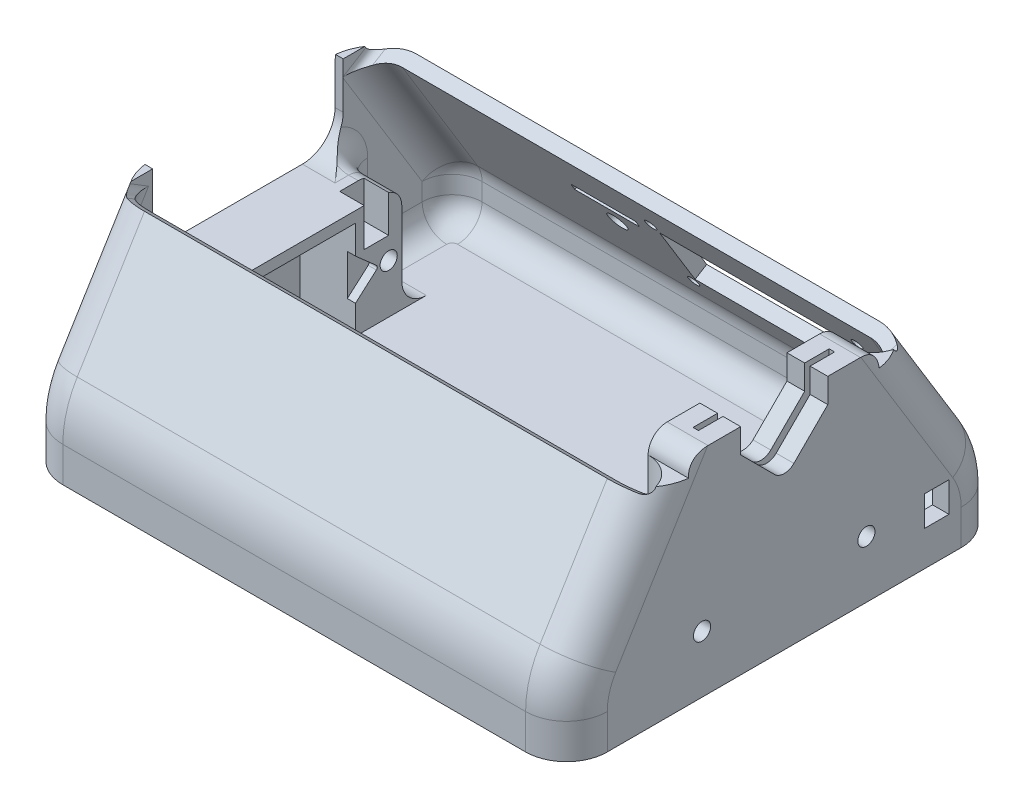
SolidWorks part; units mm, degrees
ref_plane "Front Plane" through (0, 0, 0) normal (0, 0, 1) x (1, 0, 0)
ref_plane "Top Plane" through (0, 0, 0) normal (0, 1, 0) x (1, 0, 0)
ref_plane "Right Plane" through (0, 0, 0) normal (1, 0, 0) x (0, 0, -1)
imported_body "base-1-solid1"
imported_body "Motor Cover-1-solid1"
imported_body "injectionholder-1-solid1"
combine bodies "Combine1" operation type add bodies to combine 102 101 103
sketch "Sketch1" plane through (-5.1704, 0, 0) normal (-1, 0, 0) x (0, 0, 1)
  line L0 (76.7153, 97.4092) -> (76.7153, 117.4092)
  line L1 (121.7153, 130.4092) -> (121.7153, 166.4092)
  line L2 (121.7153, 166.4092) -> (106.7153, 166.4092)
  line L3 (76.7153, 117.4092) -> (106.7153, 166.4092)
  line L4 (76.7153, 117.4092) -> (121.7153, 117.4092) construction
  line L5 (121.7153, 130.4092) -> (121.7153, 97.4092) construction
  line L6 (121.7153, 130.4092) -> (121.7153, 97.4092)
  line L7 (121.7153, 97.4092) -> (76.7153, 97.4092)
  dimension "D1" = 20
  dimension "D2" = 15
  dimension "D3" = 69
extrude "Boss-Extrude1" add sketch "Sketch1" against normal blind 3 separate body
sketch "Sketch2" plane through (194.8296, 0, 0) normal (1, 0, 0) x (0, 0, -1)
  line L0 (-76.7153, 97.4092) -> (-76.7153, 117.4092)
  line L1 (-76.7153, 117.4092) -> (-106.7153, 166.4092)
  line L2 (-106.7153, 166.4092) -> (-121.7153, 166.4092)
  line L3 (-121.7153, 166.4092) -> (-121.7153, 97.4092)
  line L4 (-121.7153, 97.4092) -> (-76.7153, 97.4092)
extrude "Boss-Extrude2" add sketch "Sketch2" against normal blind 3
combine bodies "Combine2" operation type add bodies to combine 105 106
sketch "Sketch4" plane through (-5.1704, 0, 0) normal (-1, 0, 0) x (0, 0, 1)
  line L0 (191.7153, 97.4092) -> (191.7153, 166.4092)
  line L1 (191.7153, 166.4092) -> (206.7153, 166.4092)
  line L2 (191.7153, 97.4092) -> (236.7153, 97.4092)
  line L3 (236.7153, 97.4092) -> (236.7153, 117.4092)
  line L4 (236.7153, 117.4092) -> (206.7153, 166.4092)
  dimension "D1" = 15
  dimension "D2" = 20
extrude "Boss-Extrude3" add sketch "Sketch4" against normal blind 3
sketch "Sketch5" plane through (194.8296, 0, 0) normal (1, 0, 0) x (0, 0, -1)
  line L0 (-191.7153, 97.4092) -> (-191.7153, 166.4092)
  line L1 (-191.7153, 166.4092) -> (-206.7153, 166.4092)
  line L2 (-206.7153, 166.4092) -> (-236.7153, 117.4092)
  line L3 (-236.7153, 117.4092) -> (-236.7153, 97.4092)
  line L4 (-236.7153, 97.4092) -> (-191.7153, 97.4092)
extrude "Boss-Extrude4" add sketch "Sketch5" against normal blind 3
sketch "Sketch6" plane through (0, 0, 236.7153) normal (0, 0, 1) x (1, 0, 0)
  line L1 (-5.1704, 94.4092) -> (194.8296, 94.4092)
  line L2 (-5.1704, 94.4092) -> (-5.1704, 117.4092)
  line L3 (-5.1704, 117.4092) -> (194.8296, 117.4092)
  line L4 (194.8296, 94.4092) -> (194.8296, 117.4092)
extrude "Boss-Extrude5" add sketch "Sketch6" against normal blind 3
sketch "Sketch8" plane through (0, 137.425, 224.4608) normal (0, 0.5222, 0.8529) x (1, 0, 0)
  line L1 (194.8296, 33.9851) -> (-5.1704, 33.9851)
  line L2 (194.8296, 33.9851) -> (194.8296, -23.4692)
  line L3 (194.8296, -23.4692) -> (-5.1704, -23.4692)
  line L4 (-5.1704, 33.9851) -> (-5.1704, -23.4692)
extrude "Boss-Extrude8" add sketch "Sketch8" against normal blind 3
sketch "Sketch9" plane through (0, 0, 76.7153) normal (0, 0, -1) x (-1, 0, 0)
  line L1 (-194.8296, 117.4092) -> (5.1704, 117.4092)
  line L2 (-194.8296, 117.4092) -> (-194.8296, 94.4092)
  line L3 (-194.8296, 94.4092) -> (5.1704, 94.4092)
  line L4 (5.1704, 117.4092) -> (5.1704, 94.4092)
extrude "Boss-Extrude9" add sketch "Sketch9" against normal blind 5
sketch "Sketch10" plane through (0, -2.1519, 3.5147) normal (0, 0.5222, -0.8529) x (-1, 0, 0)
  line L1 (-194.8296, 197.6441) -> (5.1704, 197.6441)
  line L2 (-194.8296, 197.6441) -> (-194.8296, 140.1898)
  line L3 (-194.8296, 140.1898) -> (5.1704, 140.1898)
  line L4 (5.1704, 197.6441) -> (5.1704, 140.1898)
extrude "Boss-Extrude10" add sketch "Sketch10" against normal blind 5
sketch "Sketch11" plane through (0, -2.1519, 3.5147) normal (0, 0.5222, -0.8529) x (-1, 0, 0)
  line L0 (-94.8296, 197.6441) -> (-94.8296, 140.1898) construction
  line L1 (2.1704, 197.6441) -> (-191.8296, 197.6441) construction
  line L2 (-194.8296, 140.1898) -> (5.1704, 140.1898) construction
  line L5 (-94.8296, 181.417) -> (-94.8296, 156.417) construction
  line L6 (-130.8296, 181.417) -> (-130.8296, 156.417) construction
  line L7 (-94.8296, 181.417) -> (-166.8296, 181.417)
  line L8 (-94.8296, 181.417) -> (-94.8296, 156.417)
  line L9 (-94.8296, 156.417) -> (-166.8296, 156.417)
  line L10 (-166.8296, 181.417) -> (-166.8296, 156.417)
  line L11 (-170.8296, 186.917) -> (-168.7102, 184.0069) construction
  line L12 (-170.8296, 186.917) -> (-90.8296, 186.917) construction
  line L13 (-170.8296, 186.917) -> (-170.8296, 150.917) construction
  line L14 (-170.8296, 150.917) -> (-90.8296, 150.917) construction
  line L15 (-90.8296, 186.917) -> (-90.8296, 150.917) construction
  line L16 (-170.8296, 186.917) -> (-90.8296, 150.917) construction
  line L17 (-170.8296, 150.917) -> (-90.8296, 186.917) construction
  line L18 (-170.8296, 150.917) -> (-168.701, 153.8203) construction
  line L19 (-90.8296, 186.917) -> (-92.9035, 183.9744) construction
  line L20 (-90.8296, 150.917) -> (-92.9466, 153.8287) construction
  line L22 (-66.7296, 175.017) -> (-66.7296, 177.517) construction
  line L23 (-78.9296, 175.017) -> (-66.7296, 175.017) construction
  line L24 (-78.9296, 175.017) -> (-78.9296, 162.817) construction
  line L25 (-78.9296, 162.817) -> (-66.7296, 162.817) construction
  line L26 (-66.7296, 175.017) -> (-66.7296, 162.817) construction
  line L27 (-78.9296, 175.017) -> (-66.7296, 162.817) construction
  line L28 (-78.9296, 162.817) -> (-66.7296, 175.017) construction
  line L29 (-31.5756, 177.517) -> (-51.5756, 177.517) construction
  line L30 (-90.8296, 168.917) -> (-72.8296, 168.917) construction
  line L35 (-72.8296, 168.917) -> (-72.8296, 177.517) construction
  line L36 (-72.8296, 177.517) -> (-90.8296, 177.517) construction
  line L37 (-84.7379, 179.017) -> (-60.9212, 179.017)
  line L38 (-84.7379, 179.017) -> (-84.7379, 176.017)
  line L39 (-84.7379, 176.017) -> (-60.9212, 176.017)
  line L40 (-60.9212, 179.017) -> (-60.9212, 176.017)
  line L41 (-84.7379, 179.017) -> (-60.9212, 176.017) construction
  line L42 (-84.7379, 176.017) -> (-60.9212, 179.017) construction
  circle A0 centre (-168.7102, 184.0069) radius 2
  circle A1 centre (-92.9035, 183.9744) radius 2
  circle A2 centre (-92.9466, 153.8287) radius 2
  circle A3 centre (-168.701, 153.8203) radius 2
  circle A4 centre (-72.8296, 168.917) radius 3.5
  point P11 (-94.8296, 168.917)
  point P14 (-94.8296, 168.917)
  point P18 (-130.8296, 168.917)
  point P41 (-41.5756, 177.517)
  dimension "D9" = 4
  dimension "D10" = 4
  dimension "D11" = 4
  dimension "D12" = 4
  dimension "D13" = 7
  dimension "D1" = 25
  dimension "D2" = 72
  dimension "D3" = 80
  dimension "D4" = 36
  dimension "D5" = 3.6
  dimension "D6" = 3.6
  dimension "D7" = 3.6
  dimension "D8" = 3.6
  dimension "D14" = 12.2
  dimension "D15" = 12.2
  dimension "D16" = 2.5
  dimension "D17" = 3
  dimension "D19" = 18
extrude "Cut-Extrude1" cut sketch "Sketch11" against normal blind 7
sketch "Sketch12" plane through (0, -2.1519, 3.5147) normal (0, 0.5222, -0.8529) x (-1, 0, 0)
  circle A0 centre (-168.7102, 184.0069) radius 3
  circle A1 centre (-92.9035, 183.9744) radius 3
  circle A2 centre (-168.701, 153.8203) radius 3
  circle A3 centre (-92.9466, 153.8287) radius 3
  dimension "D1" = 6
  dimension "D2" = 6
  dimension "D3" = 6
  dimension "D4" = 6
extrude "Cut-Extrude2" cut sketch "Sketch12" against normal blind 1.2
sketch "Sketch13" plane through (0, -2.1519, 3.5147) normal (0, 0.5222, -0.8529) x (-1, 0, 0)
  line L0 (-72.8296, 179.017) -> (-72.8296, 176.017) construction
  line L3 (-60.9212, 179.017) -> (-84.7379, 179.017) construction
  line L8 (-84.7379, 176.017) -> (-60.9212, 176.017) construction
  line L10 (-85.8296, 180.517) -> (-59.8296, 180.517)
  line L11 (-85.8296, 180.517) -> (-85.8296, 174.517)
  line L12 (-85.8296, 174.517) -> (-59.8296, 174.517)
  line L13 (-59.8296, 180.517) -> (-59.8296, 174.517)
  line L14 (-85.8296, 180.517) -> (-59.8296, 174.517) construction
  line L15 (-85.8296, 174.517) -> (-59.8296, 180.517) construction
  point P6 (-72.8296, 177.517)
  dimension "D1" = 26
  dimension "D2" = 6
extrude "Cut-Extrude3" cut sketch "Sketch13" against normal blind 2
fillet "Fillet2" radius 12 2 edges at (191.8296, 131.9092, 191.7153) (191.8296, 131.9092, 121.7153)
fillet "Fillet3" radius 12 2 edges at (-3.6704, 130.4092, 121.7153) (-5.1704, 135.359, 123.7656)
fillet "Fillet4" radius 12 2 edges at (-3.6704, 130.4092, 191.7153) (-5.1704, 135.359, 189.6651)
fillet "Fillet5" radius 9 6 edges at (-2.1704, 137.4092, 131.2153) (-2.1704, 135.359, 123.7656) (-2.1704, 137.4092, 182.2153) (-2.1704, 135.359, 189.6651) (-2.1704, 113.9092, 121.7153) (-2.1704, 113.9092, 191.7153)
fillet "Fillet6" radius 11 10 edges at (94.8296, 116.0002, 81.7153) (94.8296, 116.5638, 233.7153) (191.8296, 140.7033, 218.9361) (191.8296, 106.9865, 233.7153) (-2.1704, 106.9865, 233.7153) (-2.1704, 140.7033, 218.9361) (191.8296, 106.7047, 81.7153) (191.8296, 138.8668, 95.7153) (-2.1704, 106.7047, 81.7153) (-2.1704, 139.8993, 96.3475)
fillet "Fillet7" radius 9 16 edges at (13.0896, 97.4092, 121.7153) (0.4656, 97.4092, 119.0793) (-2.1704, 97.4092, 102.7153) (1.0514, 97.4092, 84.9372) (188.3148, 97.4092, 118.2006) (191.8296, 97.4092, 101.2153) (188.6077, 97.4092, 84.9372) (13.0896, 97.4092, 191.7153) (0.4656, 97.4092, 194.3514) (-2.1704, 97.4092, 211.7153) (1.0514, 97.4092, 230.4935) (188.3148, 97.4092, 195.2301) (191.8296, 97.4092, 213.2153) (188.6077, 97.4092, 230.4935) (94.8296, 97.4092, 81.7153) (94.8296, 97.4092, 233.7153)
fillet "Fillet8" radius 36 2 edges at (94.8296, 117.4092, 76.7153) (94.8296, 117.4092, 236.7153)
fillet "Fillet9" radius 15 22 edges at (-5.1704, 166.4092, 199.2153) (194.8296, 166.4092, 199.2153) (194.8296, 146.2354, 219.0667) (191.8296, 165.4908, 205.2153) (191.8296, 165.4908, 108.2153) (-5.1704, 100.8366, 236.7153) (194.8296, 100.8366, 76.7153) (194.8296, 166.4092, 114.2153) (194.8296, 100.8366, 236.7153) (191.8296, 166.4092, 205.2153) (191.8296, 165.4908, 203.7153) (191.8296, 165.4908, 109.7153) (191.8296, 166.4092, 108.2153) (194.8296, 146.2354, 94.364) (-5.1704, 100.8366, 76.7153) (-5.1704, 146.2354, 219.0667) (-5.1704, 117.0289, 235.3657) (-5.1704, 117.0289, 78.065) (194.8296, 117.0289, 235.3657) (194.8296, 117.0289, 78.065) (-5.1704, 146.2354, 94.364) (-5.1704, 166.4092, 114.2153)
sketch "Sketch15" plane through (179.8296, 0, 0) normal (-1, 0, 0) x (0, 0, 1)
  line L0 (126.5303, 115.4092) -> (126.5303, 123.4092) construction
  line L2 (126.5303, 123.4092) -> (135.5303, 123.4092)
  line L3 (126.5303, 123.4092) -> (126.5303, 163.4092)
  line L4 (126.5303, 163.4092) -> (135.5303, 163.4092)
  line L5 (135.5303, 123.4092) -> (135.5303, 163.4092)
  dimension "D1" = 8
  dimension "D2" = 9
  dimension "D3" = 40
extrude "Cut-Extrude5" cut sketch "Sketch15" against normal blind 9
sketch "Sketch16" plane through (19.3496, 0, 0) normal (1, 0, 0) x (0, 0, -1)
  line L0 (-126.5303, 115.4092) -> (-126.5303, 123.4092) construction
  line L2 (-126.5303, 123.4092) -> (-135.5303, 123.4092)
  line L3 (-126.5303, 123.4092) -> (-126.5303, 143.4092)
  line L4 (-126.5303, 143.4092) -> (-135.5303, 143.4092)
  line L5 (-135.5303, 123.4092) -> (-135.5303, 143.4092)
  dimension "D1" = 8
  dimension "D2" = 9
  dimension "D3" = 20
extrude "Cut-Extrude6" cut sketch "Sketch16" against normal blind 9
sketch "Sketch17" plane through (194.8296, 0, 0) normal (1, 0, 0) x (0, 0, -1)
  line L0 (-91.7153, 107.264) -> (-96.2153, 107.264) construction
  line L2 (-96.2153, 107.264) -> (-105.2153, 107.264)
  line L3 (-96.2153, 107.264) -> (-96.2153, 118.264)
  line L4 (-96.2153, 118.264) -> (-105.2153, 118.264)
  line L5 (-105.2153, 107.264) -> (-105.2153, 118.264)
  dimension "D1" = 4.5
  dimension "D2" = 9
  dimension "D3" = 11
extrude "Cut-Extrude7" cut sketch "Sketch17" against normal blind 3
sketch "Sketch18" plane through (191.8296, 0, 0) normal (-1, 0, 0) x (0, 0, 1)
  line L0 (96.2153, 107.264) -> (96.2153, 104.264)
  line L1 (96.2153, 104.264) -> (105.2153, 104.264)
  line L2 (105.2153, 104.264) -> (105.2153, 107.264)
  line L3 (96.2153, 107.264) -> (105.2153, 107.264)
  dimension "D1" = 3
  dimension "D2" = 9
extrude "Boss-Extrude11" add sketch "Sketch18" along normal blind 3
sketch "Sketch20" plane through (179.8296, 0, 0) normal (-1, 0, 0) x (0, 0, 1)
  line L1 (126.5303, 163.4092) -> (118.8521, 163.4092)
  line L2 (126.5303, 163.4092) -> (126.5303, 157.4092)
  line L3 (126.5303, 157.4092) -> (118.8521, 157.4092)
  line L4 (118.8521, 163.4092) -> (118.8521, 157.4092)
  dimension "D1" = 6
extrude "Cut-Extrude8" cut sketch "Sketch20" against normal blind 9
fillet "Fillet11" radius 3 4 edges at (-2.1704, 160.6655, 116.0967) (-2.1704, 161.1877, 198.1868) (191.3191, 162.4524, 200.2526) (191.1557, 162.1451, 113.68)
fillet "Fillet12" radius 3 1 edges at (72.8296, 144.8942, 93.5429)
sketch "Sketch22" plane through (191.8296, 0, 0) normal (-1, 0, 0) x (0, 0, 1)
  line L0 (96.2153, 107.264) -> (96.2153, 118.264) construction
  line L1 (105.1513, 104.2938) -> (108.2513, 104.2938)
  line L2 (105.1513, 104.2938) -> (105.1513, 118.2938)
  line L3 (105.1513, 118.2938) -> (108.2513, 118.2938)
  line L4 (108.2513, 104.2938) -> (108.2513, 118.2938)
  line L5 (96.2153, 118.264) -> (93.2153, 118.264)
  line L6 (96.2153, 118.264) -> (96.2153, 104.264)
  line L7 (96.2153, 104.264) -> (93.2153, 104.264)
  line L8 (93.2153, 118.264) -> (93.2153, 104.264)
  line L9 (96.2153, 118.264) -> (105.2153, 118.264) construction
  dimension "D1" = 3.1
  dimension "D2" = 3
  dimension "D3" = 14
  dimension "D4" = 14
extrude "Boss-Extrude13" add sketch "Sketch22" along normal blind 3
